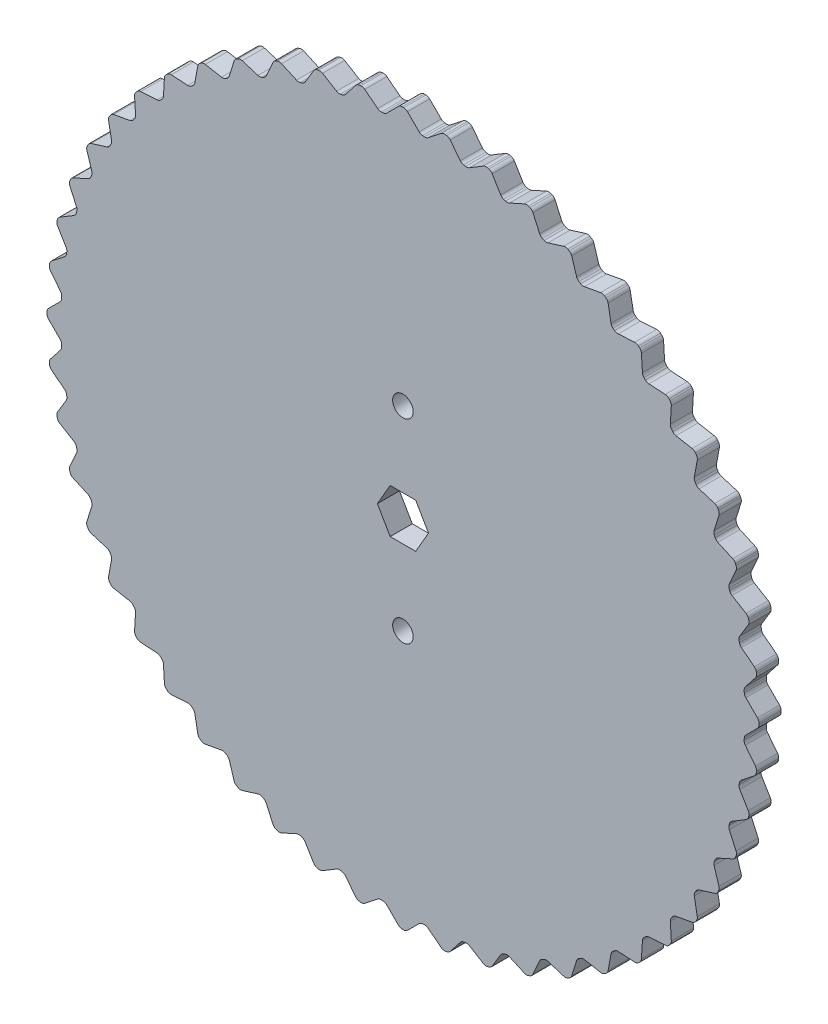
SolidWorks part; units mm, degrees
ref_plane "Front Plane" through (0, 0, 0) normal (0, 0, 1) x (1, 0, 0)
ref_plane "Top Plane" through (0, 0, 0) normal (0, 1, 0) x (1, 0, 0)
ref_plane "Right Plane" through (0, 0, 0) normal (1, 0, 0) x (0, 0, -1)
sketch "Sketch2" plane through (0, 0, 0) normal (0, 0, 1) x (1, 0, 0)
  line L0 (0, 0) -> (0, 44.1565) construction
  line L1 (0, 0) -> (-2.6731, 44.212) construction
  line L2 (0.4318, 51.0806) -> (-0.4318, 51.0806)
  line L3 (-0.4318, 51.0806) -> (-2.529, 48.9834)
  line L4 (0.4318, 51.0806) -> (2.529, 48.9834)
  circle A0 centre (0, 0) radius 49.0486 construction
  arc A1 (-2.529, 48.9834) -> (-2.9602, 48.9592) centre (0, 0) ccw
  arc A2 (2.529, 48.9834) -> (2.9602, 48.9592) centre (0, 0) cw
  arc A3 (-2.9602, 48.9592) -> (2.9602, 48.9592) centre (0, 49.0486) ccw
  point P3 (0, 49.0486)
  point P11 (0, 51.0806)
  dimension "D1" = 3.46
  dimension "D5" = 0.4318
  dimension "D2" = 0.4318
  dimension "D3" = 2.032
  dimension "D4" = 45
extrude "Boss-Extrude1" add sketch "Sketch2" along normal blind 3.175
sketch "Sketch3" plane through (0, 0, 0) normal (0, 0, 1) x (1, 0, 0)
  circle A0 centre (0, 0) radius 49.0486
  arc A1 (-2.529, 48.9834) -> (-2.9602, 48.9592) centre (0, 0) ccw construction
extrude "Boss-Extrude2" add sketch "Sketch3" along normal blind 3.175
fillet "Fillet1" radius 0.762 4 edges at (2.529, 48.9834, 1.5875) (0.4318, 51.0806, 1.5875) (-0.4318, 51.0806, 1.5875) (-2.529, 48.9834, 1.5875)
pattern_circular "CirPattern1" count 52 over 360 about axis through (0, 0, 0) along (0, 0, 1) of "Fillet1", "Boss-Extrude1"
sketch "Sketch4" plane through (0, 0, 3.175) normal (0, 0, 1) x (1, 0, 0)
  line L1 (1.8331, -3.175) -> (3.6662, 0)
  line L2 (3.6662, 0) -> (1.8331, 3.175)
  line L3 (1.8331, 3.175) -> (-1.8331, 3.175)
  line L4 (-1.8331, 3.175) -> (-3.6662, 0)
  line L5 (-3.6662, 0) -> (-1.8331, -3.175)
  line L6 (-1.8331, -3.175) -> (1.8331, -3.175)
  circle A0 centre (0, 0) radius 3.175 construction
  dimension "D1" = 6.35
extrude "Cut-Extrude1" cut sketch "Sketch4" against normal through all
hole_wizard "#4 Clearance Hole1" positions "Sketch6" profile "Sketch5" hole size "#4" standard "ANSI Inch"
sketch "Sketch6" plane through (0, 0, 3.175) normal (0, 0, 1) x (1, 0, 0)
  point P0 (0, 13.97)
  point P4 (0, -13.97)
  dimension "D1" = 13.97
  dimension "D2" = 13.97
sketch "Sketch5" plane through (0, 13.97, 3.175) normal (1, 0, 0) x (0, -1, 0)
  line L0 (0, 0) -> (0, 3.175)
  line L1 (0, 3.175) -> (1.4732, 3.175)
  line L2 (1.4732, 3.175) -> (1.4732, 0)
  line L5 (1.4732, 0) -> (0, 0)
  line L11 (0, -6.35) -> (0, 107.95) construction
  dimension "Thru Hole Dia." = 2.9464
  dimension "Thru Hole Depth" = 3.175
